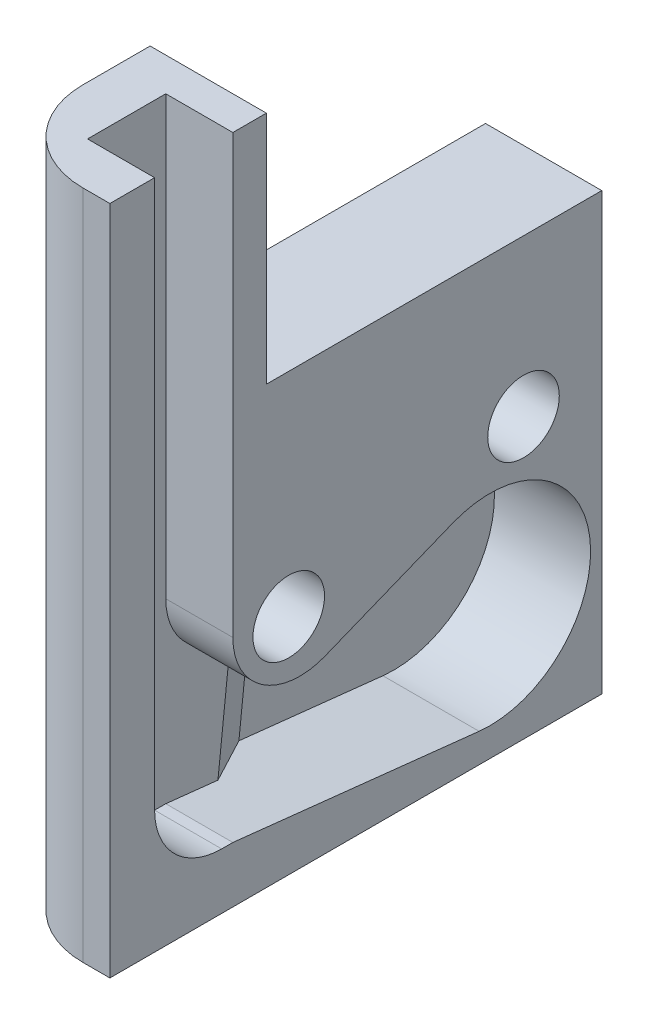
SolidWorks part; units mm, degrees
ref_plane "Plano frontal" through (0, 0, 0) normal (0, 0, 1) x (1, 0, 0)
ref_plane "Plano superior" through (0, 0, 0) normal (0, 1, 0) x (1, 0, 0)
ref_plane "Plano direito" through (0, 0, 0) normal (1, 0, 0) x (0, 0, -1)
sketch "Esboço1" plane through (0, 0, 0) normal (1, 0, 0) x (0, 0, -1)
  line L0 (0, 0) -> (-22, 0)
  line L1 (-22, 0) -> (-22, 30)
  line L2 (-22, 30) -> (-15, 30)
  line L3 (-15, 30) -> (-15, 19.5)
  line L4 (-15, 19.5) -> (0, 19.5)
  line L5 (0, 19.5) -> (0, 0)
  dimension "D1" = 19.5
  dimension "D2" = 30
  dimension "D3" = 7
  dimension "D4" = 15
extrude "Ressalto-extrusão1" add sketch "Esboço1" along normal blind 5.2
sketch "Esboço2" plane through (0, 0, 0) normal (-1, 0, 0) x (0, 0, 1)
  line L0 (16.5, 30) -> (16.5, 6)
  line L1 (15, 30) -> (22, 30) construction
  line L4 (5.4875, 1.3) -> (16.5, 2.5)
  line L5 (16.5, 2.5) -> (20, 2.5)
  line L6 (20, 2.5) -> (20, 30)
  line L7 (20, 30) -> (16.5, 30)
  line L8 (6.6786, 9.9487) -> (16.5, 6)
  line L9 (22, 0) -> (0, 0) construction
  line L12 (22, 30) -> (22, 0) construction
  line L15 (0.5, 5.7735) -> (0.5, 14.1468) construction
  line L16 (0, 0) -> (0, 19.5) construction
  line L17 (0.5, 5.7735) -> (12.9809, 5.7735) construction
  arc A1 (6.6786, 9.9487) -> (5.4875, 1.3) centre (5, 5.7735) ccw
  dimension "D1" = 27.5
  dimension "D4" = 4.5
  dimension "D6" = 0.5
  dimension "D2" = 3.5
  dimension "D3" = 3.5
  dimension "D5" = 1.3
  dimension "D7" = 2
extrude "Corte-extrusão1" cut sketch "Esboço2" against normal blind 3
fillet "Filete1" radius 3 2 edges at (1.5, 6, 16.5) (1.5, 2.5, 20)
sketch "Esboço3" plane through (3, 0, 0) normal (-1, 0, 0) x (0, 0, 1)
  line L0 (5.4875, 1.3) -> (16.5, 2.5) construction
  line L1 (12.3809, 7.6561) -> (6.6786, 9.9487) construction
  line L2 (5.4875, 1.3) -> (14.5118, 2.2833)
  line L3 (12.3809, 7.6561) -> (6.6786, 9.9487)
  line L4 (13.9463, 7.4729) -> (14.5118, 2.2833)
  arc A0 (12.3809, 7.6561) -> (16.5, 10.4395) centre (13.5, 10.4395) ccw construction
  arc A1 (6.6786, 9.9487) -> (5.4875, 1.3) centre (5, 5.7735) ccw construction
  arc A2 (12.3809, 7.6561) -> (13.9463, 7.4729) centre (13.5, 10.4395) ccw
  arc A3 (6.6786, 9.9487) -> (5.4875, 1.3) centre (5, 5.7735) ccw
  dimension "D1" = 2
extrude "Corte-extrusão2" cut sketch "Esboço3" against normal blind 1.3
chamfer "Chanfro1" distance 1.5 angle 60 1 edges at (4.3, 4.8781, 14.229)
sketch "Esboço4" plane through (5.2, 0, 0) normal (1, 0, 0) x (0, 0, -1)
  circle A0 centre (-14, 10) radius 1.6
  circle A1 centre (-3.5, 12.5) radius 1.6
  circle A2 centre (-3.5, 12.5) radius 1.25 construction
  circle A3 centre (-14, 10) radius 1.25 construction
  dimension "D1" = 3.2
extrude "Corte-extrusão3" cut sketch "Esboço4" against normal up to next
move or copy body "Corpo-Mover/Copiar1" bodies to move or copy 105
fillet "Filete2" radius 4 1 edges at (-5.2, 15, 22)
